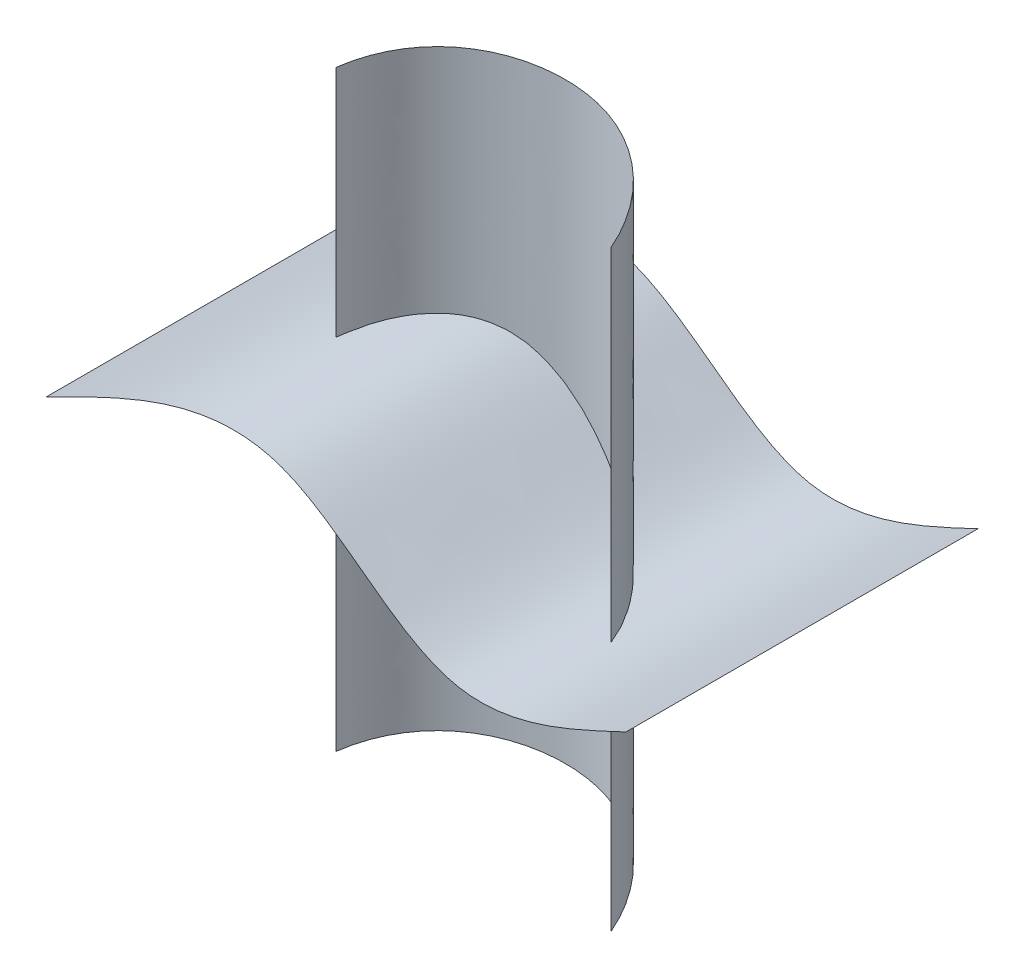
SolidWorks part; units mm, degrees
ref_plane "Front" through (0, 0, 0) normal (0, 0, 1) x (1, 0, 0)
ref_plane "Top" through (0, 0, 0) normal (0, 1, 0) x (1, 0, 0)
ref_plane "Right" through (0, 0, 0) normal (1, 0, 0) x (0, 0, -1)
sketch "Sketch1" plane through (0, 0, 0) normal (0, 0, 1) x (1, 0, 0)
  spline_without_curve S0
surface "Surface-Extrude1" sketch "Sketch1" parameters "D1"=101
sketch "Sketch2" plane through (0, 0, 0) normal (0, 1, 0) x (1, 0, 0)
  spline S0 degree 3 poles (-34.8002, -11.8996) (-31.3451, 12.7007) (11.4361, 28.5872) (42.1501, -0.4428) (49.385, -17.2278) knots 0 0 0 0 0.533179 1 1 1 1
surface "Surface-Extrude3" sketch "Sketch2" parameters "D1"=170
